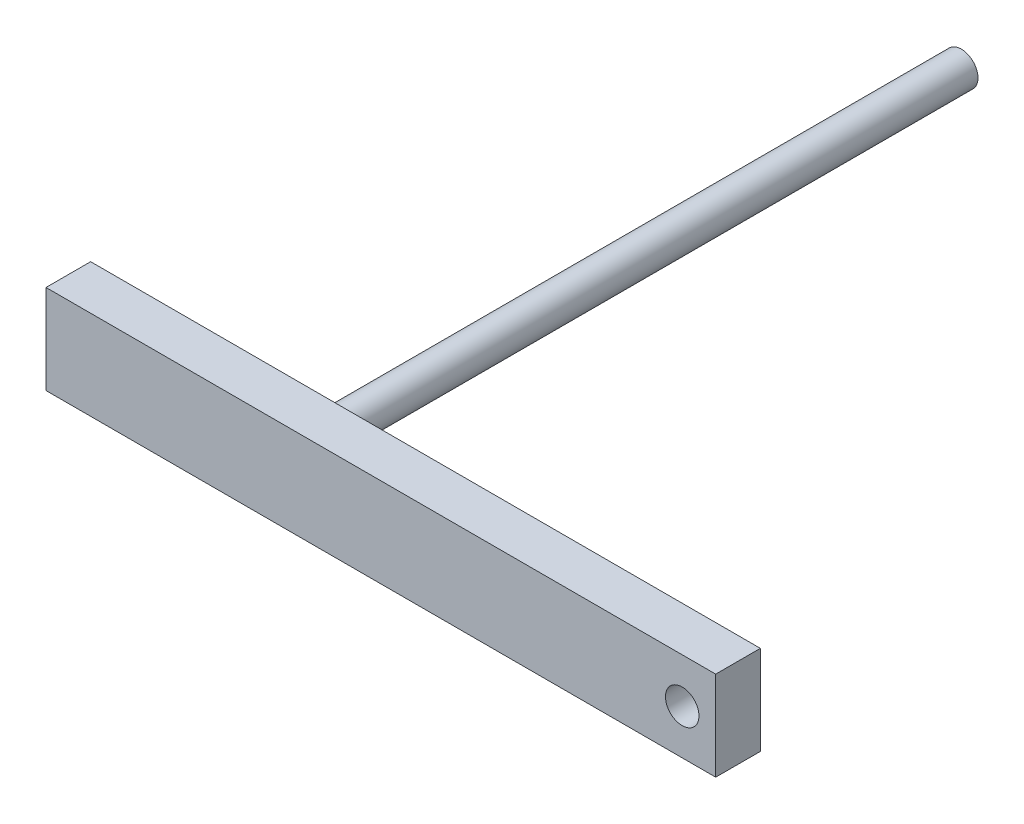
SolidWorks part; units mm, degrees
ref_plane "Plan de face" through (0, 0, 0) normal (0, 0, 1) x (1, 0, 0)
ref_plane "Plan de dessus" through (0, 0, 0) normal (0, 1, 0) x (1, 0, 0)
ref_plane "Plan de droite" through (0, 0, 0) normal (1, 0, 0) x (0, 0, -1)
sketch "Esquisse1" plane through (0, 0, 0) normal (0, 0, 1) x (1, 0, 0)
  line L1 (-30, -4) -> (30, -4)
  line L2 (-30, -4) -> (-30, 4)
  line L3 (-30, 4) -> (30, 4)
  line L4 (30, -4) -> (30, 4)
  line L5 (-30, -4) -> (30, 4) construction
  line L6 (-30, 4) -> (30, -4) construction
  point P0 (0, 0)
  dimension "D1" = 60
  dimension "D2" = 8
extrude "Boss.-Extru.1" add sketch "Esquisse1" along normal blind 4
sketch "Esquisse2" plane through (0, 0, 0) normal (0, 0, -1) x (-1, 0, 0)
  line L0 (30, 4) -> (30, -4) construction
  line L2 (30, -4) -> (-30, -4) construction
  circle A0 centre (10, 0) radius 1.5
  dimension "D3" = 3
  dimension "D1" = 20
  dimension "D2" = 4
extrude "Boss.-Extru.2" add sketch "Esquisse2" along normal blind 58
sketch "Esquisse3" plane through (0, 0, 0) normal (0, 0, -1) x (-1, 0, 0)
  line L0 (-30, -4) -> (-30, 4) construction
  line L1 (30, -4) -> (-30, -4) construction
  circle A0 centre (-27, 0) radius 1.5
  dimension "D1" = 3
  dimension "D2" = 3
  dimension "D3" = 4
extrude "Enlèv. mat.-Extru.1" cut sketch "Esquisse3" against normal through all contours A0
